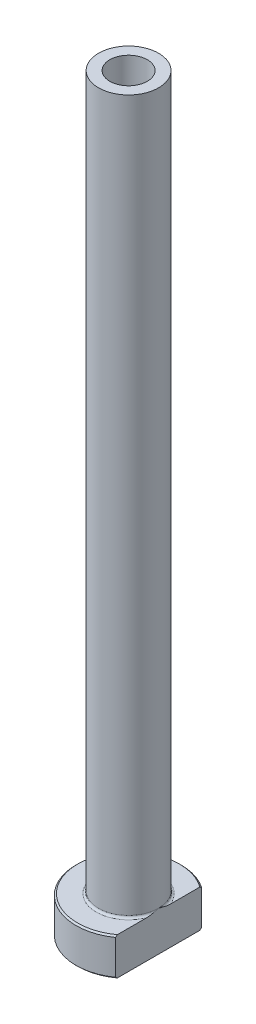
SolidWorks part; units mm, degrees
ref_plane "Front Plane" through (0, 0, 0) normal (0, 0, 1) x (1, 0, 0)
ref_plane "Top Plane" through (0, 0, 0) normal (0, 1, 0) x (1, 0, 0)
ref_plane "Right Plane" through (0, 0, 0) normal (1, 0, 0) x (0, 0, -1)
sketch "Sketch1" plane through (0, 0, 0) normal (0, 0, 1) x (1, 0, 0)
  line L0 (-2.5, 100) -> (-4, 100)
  line L1 (-4, 100) -> (-4, 5)
  line L2 (-4, 5) -> (-7, 5)
  line L3 (-7, 5) -> (-7, 0)
  line L4 (6.05, 0) -> (-6.05, 0) construction
  line L5 (-7, 0) -> (-2.75, 0)
  line L6 (-2.5, 55) -> (-2.5, 100)
  line L7 (0, 92.1877) -> (0, -15.5353) construction
  line L8 (0, -7.7) -> (0, 7.7) construction
  line L9 (-2.5, 55) -> (-2.75, 43)
  line L10 (-2.75, 43) -> (-2.75, 0)
  dimension "D1" = 0.25
  dimension "ID" = 5
  dimension "OD" = 8
  dimension "L" = 100
  dimension "H" = 14
  dimension "T" = 5
  dimension "N" = 45
  dimension "D2" = 12
  dimension "L-N" = 55
revolve "Revolve1" add sketch "Sketch1" angle 360 about L7
fillet "Fillet1" radius 0.3 1 edges at (0, 5, 4)
chamfer "Chamfer1" distance 0.2 angle 45 2 edges at (0, 5, 7) (0, 0, 7)
sketch "Sketch2" plane through (0, 0, 0) normal (0, -1, 0) x (1, 0, 0)
  line L0 (4, 5.7446) -> (4, -5.7446)
  circle A0 centre (0, 0) radius 7 construction
  arc A1 (4, 5.7446) -> (4, -5.7446) centre (0, 0) cw
  circle A2 centre (0, 0) radius 4 construction
extrude "Cut-Extrude1" cut sketch "Sketch2" against normal through all
chamfer "Chamfer2" distance 0.5 angle 45 1 edges at (0, 0, 2.75)
